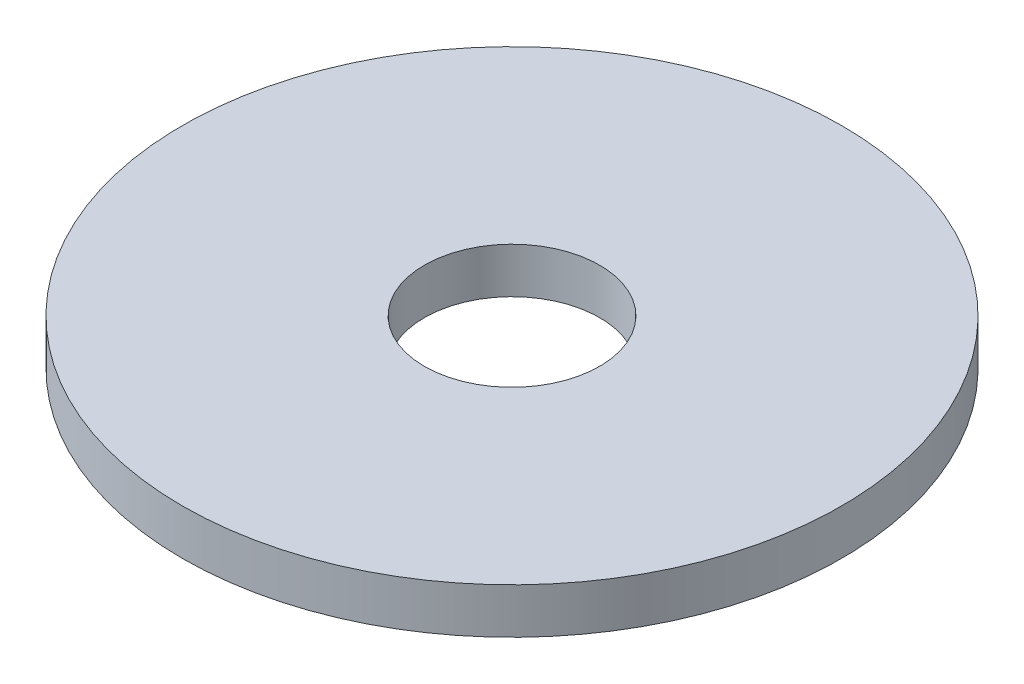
SolidWorks part; units mm, degrees
ref_plane "Front Plane" through (0, 0, 0) normal (0, 0, 1) x (1, 0, 0)
ref_plane "Top Plane" through (0, 0, 0) normal (0, 1, 0) x (1, 0, 0)
ref_plane "Right Plane" through (0, 0, 0) normal (1, 0, 0) x (0, 0, -1)
sketch "Sketch1" plane through (0, 0, 0) normal (0, 1, 0) x (1, 0, 0)
  circle A0 centre (0, 0) radius 12.7
  dimension "OD" = 25.4
extrude "Boss-Extrude1" add sketch "Sketch1" along normal blind 1.7526
sketch "Sketch5" plane through (0, 1.7526, 0) normal (0, 1, 0) x (-1, 0, 0)
  circle A0 centre (0, 0) radius 3.3782
  dimension "ID" = 6.7564
extrude "Cut-Extrude1" cut sketch "Sketch5" against normal through all
